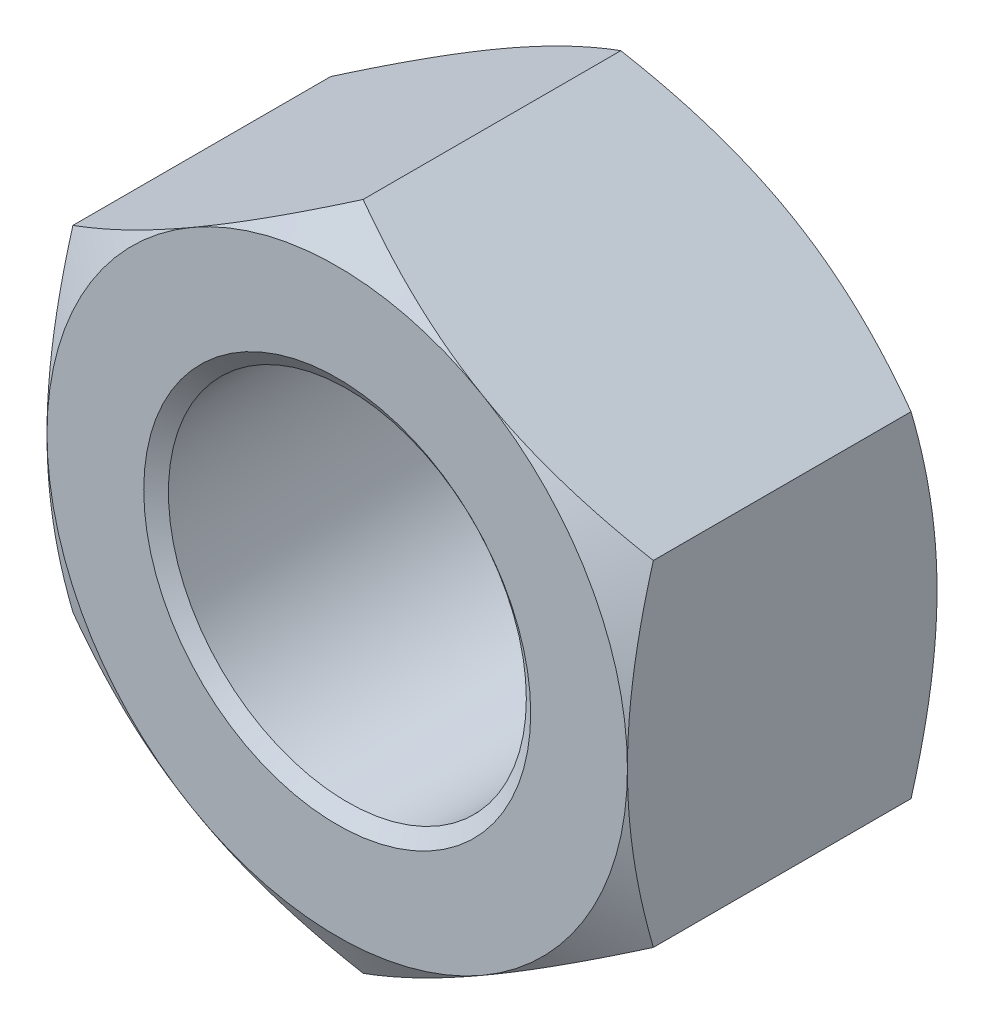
SolidWorks part; units mm, degrees
extrude "BaseNut" add sketch "BaseNutSke" against normal blind 16
sketch "BaseNutSke" plane through (0, 0, 0) normal (0, 0, 1) x (1, 0, 0)
  line L6 (15, 8.6603) -> (15, -8.6603)
  line L7 (-15, 8.6603) -> (-15, -8.6603)
  line L8 (15, 8.6603) -> (0, 17.3205)
  line L9 (0, 17.3205) -> (-15, 8.6603)
  line L10 (-15, -8.6603) -> (0, -17.3205)
  line L11 (0, -17.3205) -> (15, -8.6603)
  circle A0 centre (0, 0) radius 9.25
pattern_linear "ThdSchPat" [suppressed]
revolve "ThreadSchematic" cut sketch "ThdSchSke" angle 360 about L6
sketch "ThdSchSke" plane through (0, 0, 0) normal (0, 1, 0) x (1, 0, 0)
  line L0 (-10, 0.0254) -> (-9.25, 0.5506)
  line L1 (-9.25, 0.5506) -> (-4.625, 0.5506)
  line L2 (-4.625, 0.5506) -> (-4.625, -0.4998)
  line L3 (-4.625, -0.4998) -> (-9.25, -0.4998)
  line L4 (-9.25, -0.4998) -> (-10, 0.0254)
  line L5 (-3.175, 2.5) -> (3.175, 2.5) construction
  line L6 (0, 2.5) -> (0, -2.9874) construction
  line L7 (0, 15.4494) -> (0, 0.5252) construction
ref_plane "Plane1" through (0, 0, 0) normal (0, 0, 1) x (1, 0, 0)
ref_plane "Plane2" through (0, 0, 0) normal (0, 1, 0) x (1, 0, 0)
ref_plane "Plane3" through (0, 0, 0) normal (1, 0, 0) x (0, 0, -1)
sketch "Sketch3" plane through (0, 0, 0) normal (1, 0, 0) x (0, 0, -1)
  line L0 (16, 15) -> (14.6603, 17.3205)
  line L1 (14.6603, 17.3205) -> (14.6603, 27.3205)
  line L2 (14.6603, 27.3205) -> (26, 27.3205)
  line L3 (26, 27.3205) -> (26, 15)
  line L4 (26, 15) -> (16, 15)
  line L5 (16, 8.6603) -> (16, 17.3205) construction
  line L6 (16, 17.3205) -> (0, 17.3205) construction
  line L7 (0, 0) -> (38.6776, 0) construction
  line L8 (16, 0) -> (0, 0) construction
  line L9 (8, 17.3205) -> (8, 44.222) construction
  line L10 (1.3397, 27.3205) -> (-10, 27.3205)
  line L11 (-10, 27.3205) -> (-10, 15)
  line L12 (-10, 15) -> (0, 15)
  line L13 (0, 15) -> (1.3397, 17.3205)
  line L14 (1.3397, 17.3205) -> (1.3397, 27.3205)
  line L16 (16, 17.3205) -> (0, 17.3205) construction
revolve "Double-Chamfer" cut sketch "Sketch3" angle 360 about L7
sketch "Sketch5" plane through (0, 0, 0) normal (1, 0, 0) x (0, 0, -1)
  line L0 (15.9746, 10) -> (15.0118, 8.625)
  line L1 (16.0254, 10) -> (15.9746, 10)
  line L2 (16.0254, 10) -> (16.0254, 8.625)
  line L3 (16.0254, 8.625) -> (15.0118, 8.625)
  line L6 (-0.0508, 10) -> (0, 10)
  line L7 (0, 10) -> (0.9628, 8.625)
  line L9 (0.9628, 8.625) -> (-0.0508, 8.625)
  line L10 (-0.0508, 8.625) -> (-0.0508, 10)
  line L11 (25.0375, 0) -> (38.388, 0) construction
  line L12 (16, 0) -> (0, 0) construction
revolve "EndChamfer" cut sketch "Sketch5" angle 360 about L11
thread "Filetage1" pitch 2.5 start angle 0, offset 5, length 25, pitch 2.5, diameter 18.5
ref_plane "Plan1" through (9.25, 0, -20.4494) normal (0, -1, 0) x (1, 0, 0)
sketch "Profil de filetage1" plane through (9.25, 0, -20.4494) normal (0, -1, 0) x (1, 0, 0)
  line L0 (0, 0) -> (0, 2.5) construction
  line L1 (0, 0) -> (1.3532, 0.7812)
  line L2 (1.3532, 0.7812) -> (1.3532, 1.0937)
  line L3 (1.3532, 1.0937) -> (0, 1.875)
  line L4 (1.3532, 0.9375) -> (0, 0.9375) construction
  line L11 (0, 0) -> (0, 1.875)
  point P2 (0, 0)
  dimension "Pitch" = 2.5
  dimension "Profile_Angle" = 60
  dimension "Profile_Land" = 0.3125
  dimension "Profile_Height" = 1.3532
sketch "Esquisse4" plane through (-15, 0, 0) normal (-1, 0, 0) x (0, 0, 1)
  circle A0 centre (-8, 0) radius 2
  dimension "D1" = 4
  dimension "D2" = 8
extrude "Enlèv. mat.-Extru.1" [suppressed] cut sketch "Esquisse4" against normal through all
equation "\"D2@BaseNutSke\" = \"Width_flats@BaseNutSke\" / 2"
equation "\"D3@BaseNutSke\" = \"Width_flats@BaseNutSke\" / 2"
equation "\"D1@Sketch3\" = \"Width_flats@BaseNutSke\" /2"
equation "\"D4@BaseNutSke\" = \"D3@BaseNutSke\""
equation "\"Tap_Drill@ThdSchSke\" = \"Tap_drill@BaseNutSke\""
equation "\"OverCut@ThdSchSke\" = \"Tap_Drill@ThdSchSke\" * 0.5"
equation "\"Num_threads@ThdSchPat\" = int(  ( \"Thickness@BaseNut\" - 0.0508 ) / \"Advance@ThdSchSke\" + 0.999 )  + 1"
equation "\"Advance@ThdSchPat\" = ( \"Thickness@BaseNut\" - 0.0508 ) /  (\"Num_threads@ThdSchPat\" - 1) 'relax it"
equation "' \"Num_threads@ThdSchPat\" = \"Num_threads@ThdSchPat\" - sgn( \"Num_threads@ThdSchPat\" - 1) '---chamfered tips only---"
equation "\"Offset1@Sketch5\" = \"Thickness@BaseNut\" + 0.0254"
equation "\"Offset2@Sketch5\" = \"Offset1@Sketch5\" + 0.0508"
